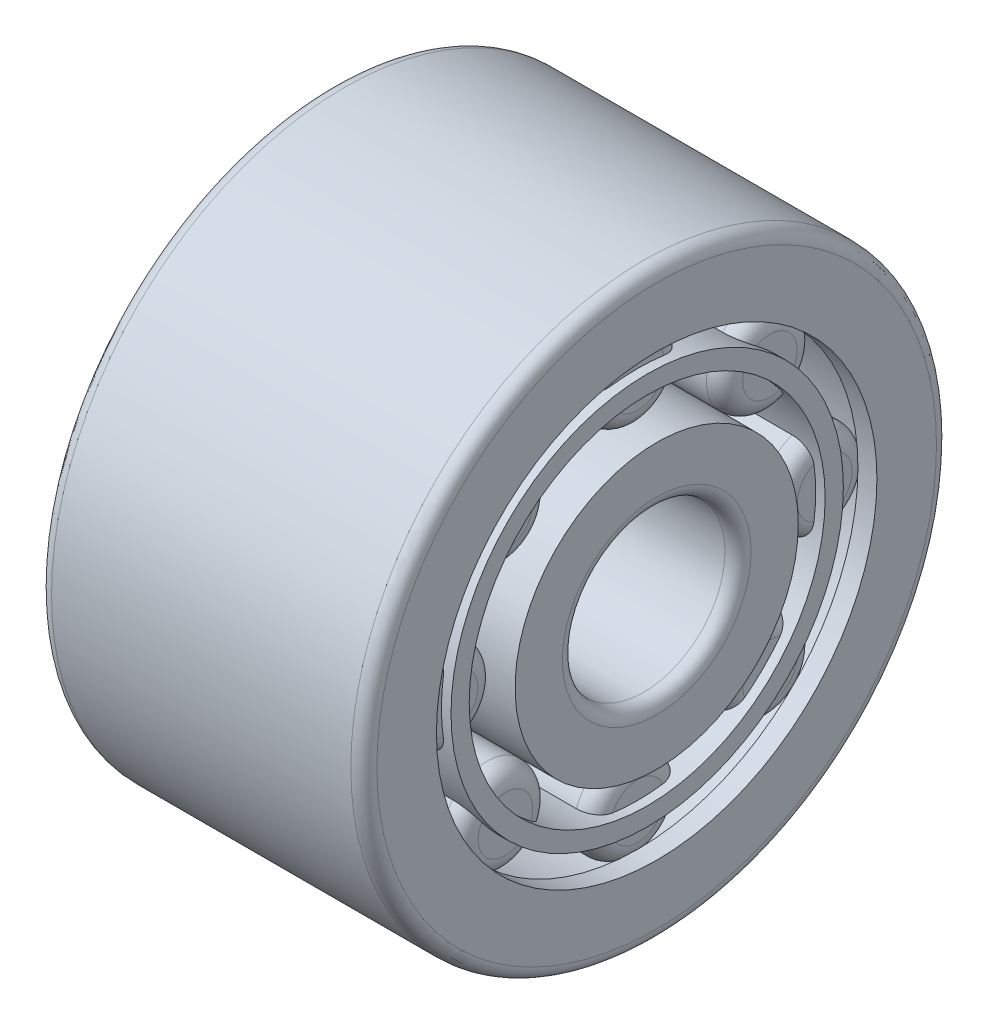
SolidWorks part; units mm, degrees
ref_plane "Plane1" through (0, 0, 0) normal (0, 0, 1) x (1, 0, 0)
ref_plane "Plane2" through (0, 0, 0) normal (0, 1, 0) x (1, 0, 0)
ref_plane "Plane3" through (0, 0, 0) normal (1, 0, 0) x (0, 0, -1)
other "Configuration Table"
sketch "Clipboard" plane through (0, 0, 0) normal (0, 0, 1) x (1, 0, 0)
  line L0 (-10, 0) -> (10, 0) construction
  line L1 (0, 0) -> (27.3694, -3.8465)
  line L2 (0, 0) -> (36.1572, 5.0816)
  line L3 (0, 0) -> (44.9449, -6.3166)
  line L4 (0, 0) -> (-22.3471, -0.7804)
sketch "OutRacSke" plane through (0, 0, 0) normal (0, 0, 1) x (1, 0, 0)
  line L0 (-14.0229, 22.6933) -> (-14.0229, 21.4933)
  line L1 (-14.0229, 21.4933) -> (-15.875, 21.4933)
  line L2 (-15.875, 21.4933) -> (-15.875, 27.305)
  line L3 (-14.605, 28.575) -> (14.605, 28.575)
  line L4 (15.875, 27.305) -> (15.875, 21.4933)
  line L5 (15.875, 21.4933) -> (14.0229, 21.4933)
  line L6 (14.0229, 21.4933) -> (14.0229, 22.6933)
  line L7 (14.0229, 22.6933) -> (-14.0229, 22.6933)
  line L8 (-7.9375, 0) -> (7.9375, 0) construction
  arc A0 (-15.875, 27.305) -> (-14.605, 28.575) centre (-14.605, 27.305) cw
  arc A1 (14.605, 28.575) -> (15.875, 27.305) centre (14.605, 27.305) cw
revolve "OuterRace" add sketch "OutRacSke" angle 360 about L8
sketch "RolDetSke" plane through (0, 0, 0) normal (0, 0, 1) x (1, 0, 0)
  line L0 (-14.0229, 20.9188) -> (-14.0229, 18.2562)
  line L1 (-14.0229, 18.2562) -> (14.0229, 18.2562)
  line L2 (14.0229, 18.2562) -> (14.0229, 20.9188)
  line L3 (12.2479, 22.6938) -> (-12.2479, 22.6938)
  line L4 (-28.575, 18.2562) -> (28.575, 18.2562) construction
  arc A0 (14.0229, 20.9188) -> (12.2479, 22.6938) centre (12.2479, 20.9188) ccw
  arc A1 (-12.2479, 22.6938) -> (-14.0229, 20.9188) centre (-12.2479, 20.9188) ccw
revolve "RollerDetailed" add sketch "RolDetSke" angle 360 about L4
ref_axis "Axis1" through (-50, 0, 0) along (1, 0, 0)
sketch "RolSimSke" plane through (0, 25.4, 0) normal (0, 0, 1) x (1, 0, 0)
  line L0 (-14.0229, -4.4807) -> (-14.0229, -9.8058)
  line L1 (-25.4, -25.4) -> (25.4, -25.4) construction
  line L2 (14.0229, -9.8058) -> (14.0229, -4.4807)
  line L3 (12.2479, -2.7057) -> (-12.2479, -2.7057)
  line L5 (12.2479, -11.5808) -> (-12.2479, -11.5808)
  arc A0 (14.0229, -4.4807) -> (12.2479, -2.7057) centre (12.2479, -4.4807) ccw
  arc A1 (-12.2479, -2.7057) -> (-14.0229, -4.4807) centre (-12.2479, -4.4807) ccw
  arc A2 (14.0229, -9.8058) -> (12.2479, -11.5808) centre (12.2479, -9.8058) cw
  arc A3 (-12.2479, -11.5808) -> (-14.0229, -9.8058) centre (-12.2479, -9.8058) cw
revolve "RollersSimplified" [suppressed] add sketch "RolSimSke" angle 360 about L1
sketch "InsRacSke" plane through (0, 0, 0) normal (0, 0, 1) x (1, 0, 0)
  line L2 (-15.875, 13.8192) -> (-15.875, 9.2075)
  line L4 (-14.605, 7.9375) -> (14.605, 7.9375)
  line L5 (15.875, 9.2075) -> (15.875, 13.8192)
  line L8 (15.875, 13.8192) -> (-15.875, 13.8192)
  line L9 (-7.9375, 0) -> (7.9375, 0) construction
  arc A0 (-15.875, 9.2075) -> (-14.605, 7.9375) centre (-14.605, 9.2075) ccw
  arc A2 (14.605, 7.9375) -> (15.875, 9.2075) centre (14.605, 9.2075) ccw
revolve "InnerRace" add sketch "InsRacSke" angle 360 about L9
sketch "CagSpiSke" plane through (0, 0, 0) normal (0, 0, 1) x (1, 0, 0)
  line L0 (-17.1595, 0) -> (17.1595, 0) construction
  line L3 (-14.949, 17.3687) -> (14.949, 17.3687)
  line L4 (-14.949, 17.3687) -> (-14.949, 19.1438)
  line L5 (-14.949, 19.1438) -> (14.949, 19.1438)
  line L6 (14.949, 17.3687) -> (14.949, 19.1438)
revolve "CageSpine" add sketch "CagSpiSke" angle 360 about L0
pattern_circular "RollersDetailed" count 8 every 45 about axis through (-50, 0, 0) along (1, 0, 0) of "RollerDetailed"
equation "\"halfWidth@OutRacSke\" =  \"Width@OutRacSke\" / 2"
equation "\"CLdia@Clipboard\" =  ( \"Race_OD@Clipboard\" + \"Race_ID@Clipboard\" )  / 2"
equation "\"CLRad@RolDetSke\" = ( \"Race_OD@Clipboard\" + \"Race_ID@Clipboard\" )  / 4"
equation "\"Roller_diameter@RolDetSke\" =  ( \"Race_OD@Clipboard\" -  \"Race_ID@Clipboard\" )  / 2 + .001"
equation "\"Roller_diameter@RolSimSke\" = ( \"Race_OD@Clipboard\" -  \"Race_ID@Clipboard\" )  / 2 + .001"
equation "\"radius@RolDetSke\" = \"Roller_diameter@RolDetSke\" / 5"
equation "\"radius@RolSimSke\" = \"Roller_diameter@RolSimSke\" / 5"
equation "\"Cyl_Len@OutRacSke\" = \"Cyl_Len@RolDetSke\""
equation "\"Cyl_Len@RolSimSke\" = \"Cyl_Len@RolDetSke\""
equation "\"halfCylLen@RolDetSke\" = \"Cyl_Len@RolDetSke\" / 2"
equation "\"D1@OutRacSke\" = \"Cyl_Len@OutRacSke\" / 2"
equation "\"cage_width@CagSpiSke\" =  ( \"Cyl_Len@RolDetSke\" + \"Width@OutRacSke\" )  / 2"
equation "\"halfwidth@CagSpiSke\" = \"cage_width@CagSpiSke\" / 2"
equation "\"cage_thickness@CagSpiSke\" = \"Roller_diameter@RolDetSke\" / 5"
equation "\"d2@CagSpiSke\" = \"CLRad@RolDetSke\" * 2 - \"cage_thickness@CagSpiSke\""
equation "\"Max_count@Clipboard\" = int( 3.14159265 / atn(( \"Roller_diameter@RolDetSke\" / 2) / sqr( \"CLRad@RolDetSke\"  *  \"CLRad@RolDetSke\" - ( \"Roller_diameter@RolDetSke\" / 2) *  ( \"Roller_diameter@RolDetSke\" / "
equation "\"Max_count@Clipboard\" = ((sgn( \"Max_count@Clipboard\" - \"Count@Clipboard\" )-1)*( \"Max_count@Clipboard\" - \"Count@Clipboard\" ))/-2+ \"Count@Clipboard\""
equation "\"Count@RollersDetailed\" = int( \"Show_count@Clipboard\" ) "
equation "\"Count@RollersDetailed\" = ((sgn( \"Count@RollersDetailed\" - \"Max_count@Clipboard\" )-1)*( \"Count@RollersDetailed\" - \"Max_count@Clipboard\" ))/-2+ \"Max_count@Clipboard\""
equation "\"Count@RollersDetailed\" = ((sgn( \"Count@RollersDetailed\" - \"Min_count@Clipboard\" )+1)*( \"Count@RollersDetailed\" - \"Min_count@Clipboard\"))/2 +\"Min_count@Clipboard\""
equation "\"Angle@RollersDetailed\" = 360.0 / \"Max_count@Clipboard\""
equation "\"Bore@RolSimSke\" = \"Race_ID@Clipboard\""
equation "\"Race_ID@InsRacSke\" = \"Race_ID@Clipboard\""
equation "\"halfWidth@InsRacSke\" = \"Width_IR@InsRacSke\" / 2"
equation "\"halfLength@RolSimSke\" = \"Cyl_Len@RolSimSke\" / 2"
equation "\"Race_OD@OutRacSke\" = \"Race_OD@Clipboard\""
equation "\"Width_IR@InsRacSke\" = \"Width@OutRacSke\""
equation "\"Angle@CageSpine\" =  \"Angle@RollersDetailed\" * ( \"Count@RollersDetailed\" -1 + int( \"Count@RollersDetailed\" / \"Max_count@Clipboard\" ) )  + 0.001 -  int( \"Count@RollersDetailed\" / \"Max_count@Clipboard\" "
equation "\"Angle@CageSpine\" =  \"Angle@CageSpine\" * int( \"Min_count@Clipboard\" / 2) + int(1 / \"Min_count@Clipboard\")  * 0.001"
equation "\"radius@InsRacSke\" = \"Radius@OutRacSke\""
